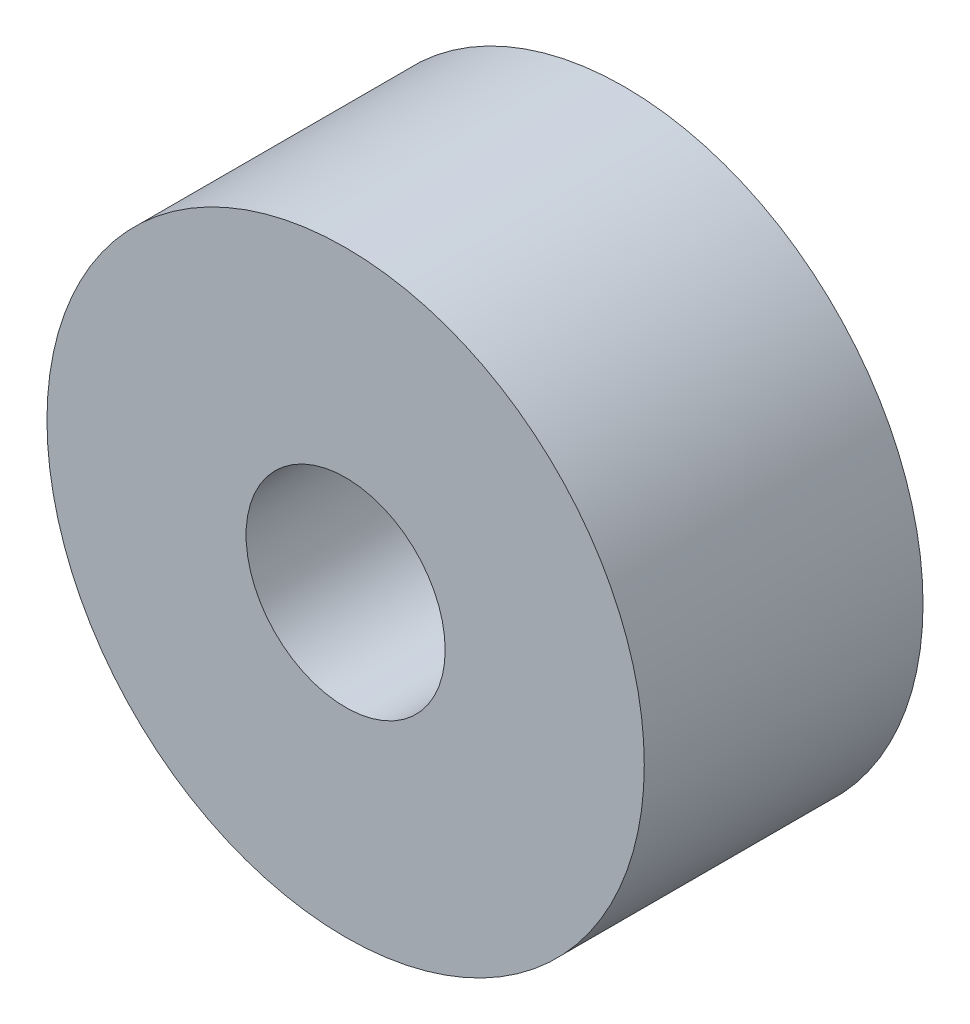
SolidWorks part; units mm, degrees
ref_plane "Face" through (0, 0, 0) normal (0, 0, 1) x (1, 0, 0)
ref_plane "Dessus" through (0, 0, 0) normal (0, 1, 0) x (1, 0, 0)
ref_plane "Droite" through (0, 0, 0) normal (1, 0, 0) x (0, 0, -1)
sketch "Esquisse1" plane through (0, 0, 0) normal (0, 0, 1) x (1, 0, 0)
  circle A0 centre (0, 0) radius 15
  circle A1 centre (0, 0) radius 5
  dimension "D1" = 30
  dimension "D2" = 10
extrude "Base-Extrusion" add sketch "Esquisse1" along normal mid plane 14
